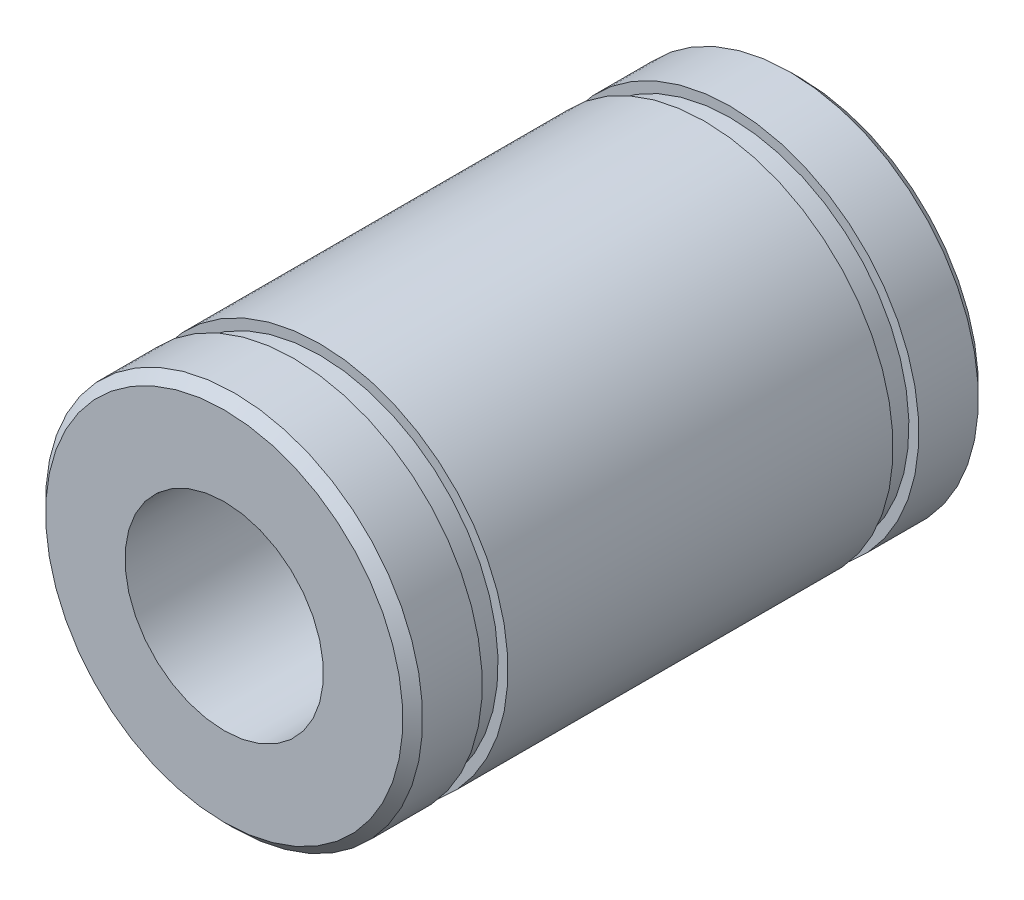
SolidWorks part; units mm, degrees
other "Solid1"
ref_plane "Front Plane" through (0, 0, 0) normal (0, 0, 1) x (1, 0, 0)
ref_plane "Top Plane" through (0, 0, 0) normal (0, 1, 0) x (1, 0, 0)
ref_plane "Right Plane" through (0, 0, 0) normal (1, 0, 0) x (0, 0, -1)
imported_body "2.7006 LM10UU.stp<1>"
move or copy body "Body-Move/Copy1" bodies to move or copy 101 copy no rotation origin (0, 14.5, 0) rotation axis (1, 0, 0) rotation angle 90
